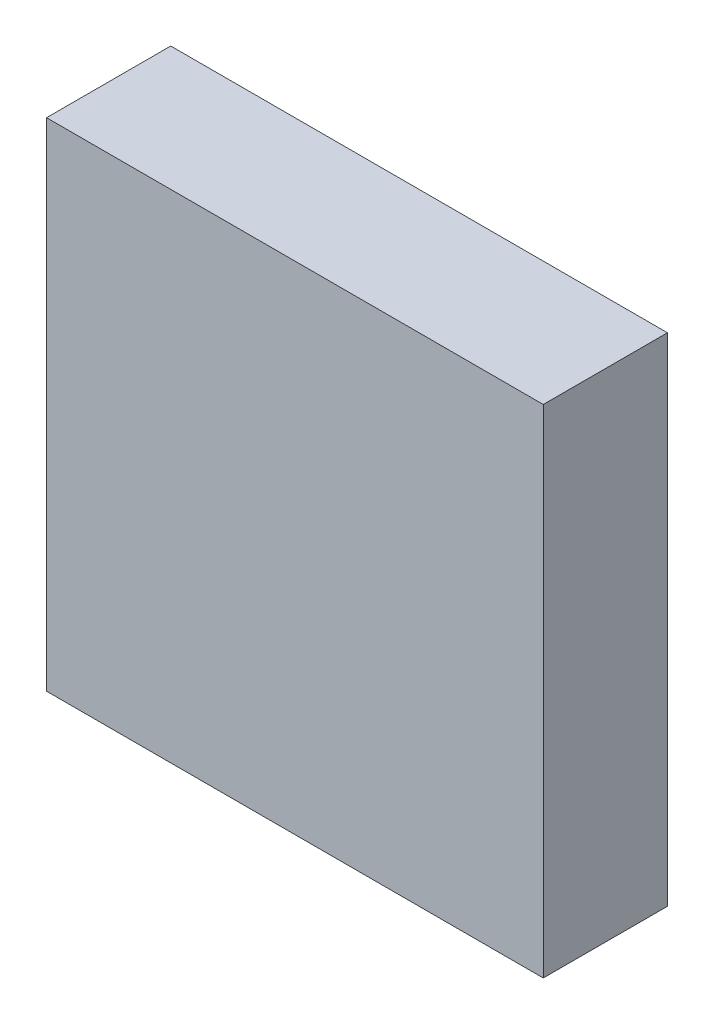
SolidWorks part; units mm, degrees
ref_plane "Front Plane" through (0, 0, 0) normal (0, 0, 1) x (1, 0, 0)
ref_plane "Top Plane" through (0, 0, 0) normal (0, 1, 0) x (1, 0, 0)
ref_plane "Right Plane" through (0, 0, 0) normal (1, 0, 0) x (0, 0, -1)
sketch "Sketch1" plane through (0, 0, 0) normal (0, 0, 1) x (1, 0, 0)
  line L1 (20, -20) -> (-20, -20)
  line L2 (20, -20) -> (20, 20)
  line L3 (20, 20) -> (-20, 20)
  line L4 (-20, -20) -> (-20, 20)
  line L5 (20, -20) -> (-20, 20) construction
  line L6 (20, 20) -> (-20, -20) construction
  point P0 (0, 0)
  dimension "D1" = 40
extrude "Boss-Extrude1" add sketch "Sketch1" along normal blind 10
